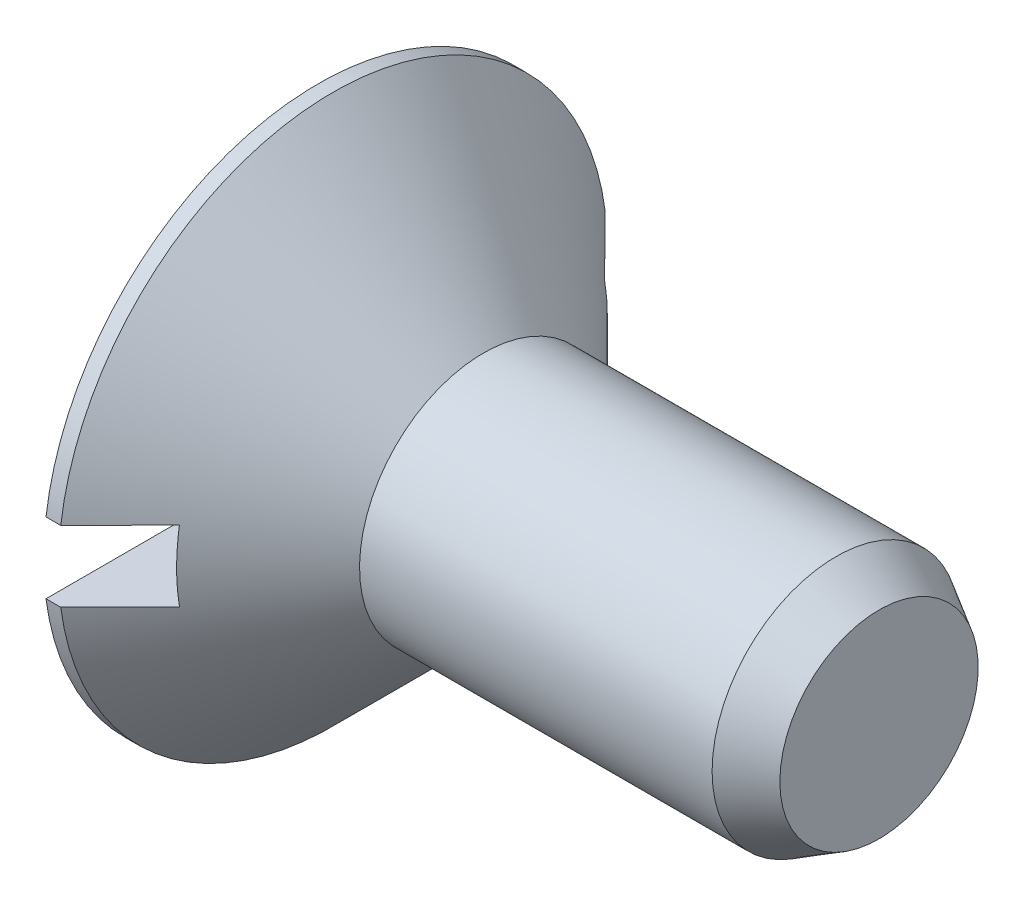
SolidWorks part; units mm, degrees
ref_plane "Front" through (0, 0, 0) normal (0, 0, 1) x (1, 0, 0)
ref_plane "Top" through (0, 0, 0) normal (0, 1, 0) x (1, 0, 0)
ref_plane "Right" through (0, 0, 0) normal (1, 0, 0) x (0, 0, -1)
other "Configuration Table"
sketch "Sketch1" plane through (0, 0, 0) normal (0, 0, 1) x (1, 0, 0)
  line L0 (0, 4.65) -> (0.25, 4.65)
  line L1 (0.25, 4.65) -> (2.8, 2.1)
  line L2 (2.8, 2.1) -> (9.5, 2.1)
  line L3 (9.5, 2.1) -> (9.5, 0)
  line L4 (9.5, 0) -> (0, 0)
  line L5 (0, 0) -> (0, 4.65)
  line L6 (6.6207, 0) -> (-0.9387, 0) construction
revolve "Revolve1" add sketch "Sketch1" angle 360 about L6
sketch "Sketch2" plane through (0, 0, 0) normal (0, 0, 1) x (1, 0, 0)
  line L0 (0, 4.65) -> (0, -4.65) construction
  line L1 (0, 0.6) -> (1.25, 0.6)
  line L2 (0, 0.6) -> (0, -0.6)
  line L3 (0, -0.6) -> (1.25, -0.6)
  line L4 (1.25, 0.6) -> (1.25, -0.6)
  dimension "n" = 1.2
  dimension "t" = 1.25
extrude "Cut-Extrude1" cut sketch "Sketch2" against normal through all and the other way through all
chamfer "Chamfer1" distance 0.42 angle 60 1 edges at (9.5, 0, -2.1)
sketch "Sketch4" plane through (0, 0, 0) normal (0, 0, 1) x (1, 0, 0)
  line L0 (3.2136, 1.9) -> (2.9636, 1.9)
  line L1 (2.9636, 1.9) -> (2.8481, 2.1)
  line L2 (3.2136, 1.9) -> (3.329, 2.1)
  line L3 (2.8481, 2.1) -> (2.8481, 2.35)
  line L4 (3.329, 2.1) -> (3.329, 2.35)
  line L5 (2.8481, 2.35) -> (3.329, 2.35)
  line L6 (3.0886, 1.9) -> (3.0886, 0) construction
  line L7 (0, 0) -> (7.3035, 0) construction
  line L9 (8.7725, 2.1) -> (2.8, 2.1) construction
  line L12 (2.8, 2.1) -> (2.8, -2.1) construction
revolve "ThreadSchematic" [suppressed] cut sketch "Sketch4" angle 360 about L7
pattern_linear "ThdSchPat" [suppressed] count 14 spacing 0.4809 along (-1, 0, 0)
sketch "Sketch3" plane through (0, 0, 0) normal (0, 0, 1) x (1, 0, 0)
  line L0 (2.8, 2.1) -> (9.5, 2.1) construction
  line L2 (7.5, 2.1) -> (8, 2.1) construction
  line L3 (9.5, 2.1) -> (9.5, 0) construction
  line L4 (8, 2.1) -> (9.5, 0)
  line L5 (2.9, 0) -> (5.4301, 0) construction
  line L6 (9.5, 0) -> (9.7, 0)
  line L7 (9.7, 0) -> (9.7, 2.1)
  line L8 (9.7, 2.1) -> (9.5, 2.1)
  line L9 (8, 2.1) -> (9.5, 2.1)
revolve "EndCone" [suppressed] cut sketch "Sketch3" angle 360 about L5
equation "\"minordia@Sketch4\" = \"D2@ThreadCosmetic\""
equation "\"D1@Chamfer1\" = \"d@Sketch1\" / 10"
equation "\"D1@Sketch3\" = \"y@Sketch3\" / 4"
equation "\"threadstart@Sketch4\" = \"advance@Sketch4\"*0.6"
equation "\"D1@ThdSchPat\" = int(((\"l@Sketch1\"-\"k@Sketch1\")/\"advance@Sketch4\") + 0.999)"
equation "\"D3@ThdSchPat\" =\"advance@Sketch4\""
